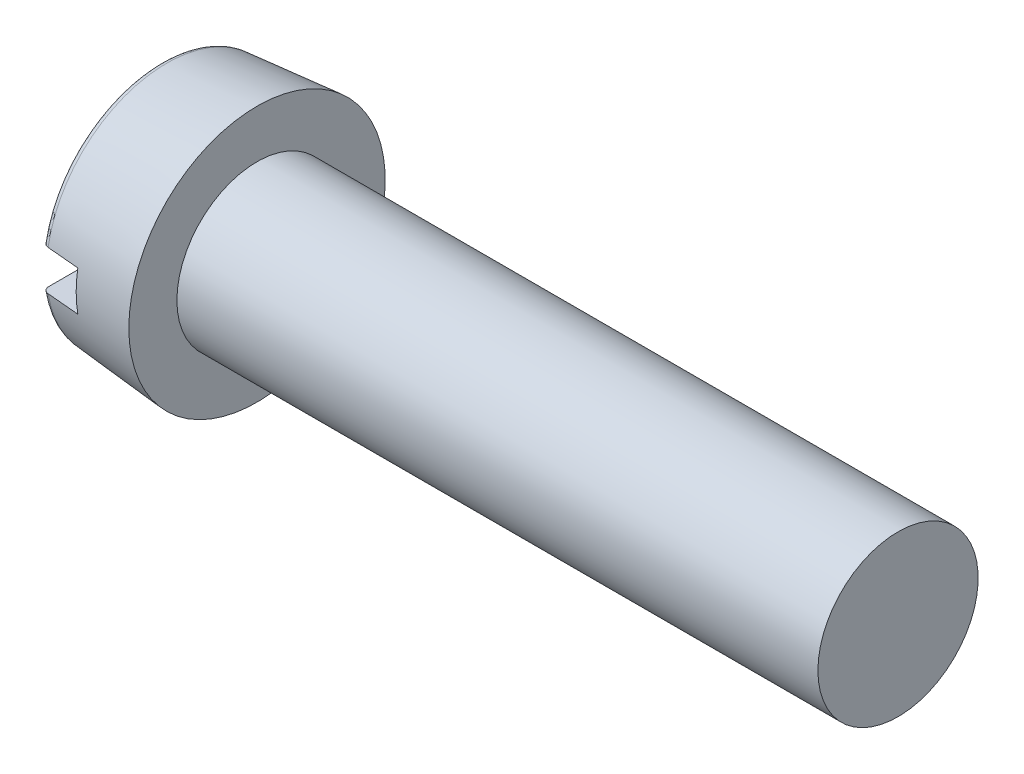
SolidWorks part; units mm, degrees
ref_plane "Front Plane" through (0, 0, 0) normal (0, 0, 1) x (1, 0, 0)
ref_plane "Top Plane" through (0, 0, 0) normal (0, 1, 0) x (1, 0, 0)
ref_plane "Right Plane" through (0, 0, 0) normal (1, 0, 0) x (0, 0, -1)
other "Configuration Table"
sketch "BodySke" plane through (0, 0, 0) normal (0, 0, 1) x (1, 0, 0)
  line L0 (0, 0) -> (111.3824, 0) construction
  line L1 (0, 0) -> (0, 7.4751)
  line L2 (0, 7.4751) -> (6, 8)
  line L3 (6, 8) -> (6, 5)
  line L4 (6, 5) -> (46, 5)
  line L5 (46, 5) -> (46, 0)
  line L6 (7.5, 8.824) -> (7.5, -5.8939) construction
  line L7 (0, 0) -> (46, 0)
  line L8 (8, 8.824) -> (8, -4.958) construction
  point P10 (46, 4.172)
revolve "BaseBody" add sketch "BodySke" angle 360 about L0
fillet "Fillet1" radius 0.4 1 edges at (0, 0, 7.4751)
sketch "SlotSke" plane through (0, 0, 0) normal (-1, 0, 0) x (0, 0, 1)
  line L1 (-8, 1.25) -> (8, 1.25)
  line L2 (-8, 1.25) -> (-8, -1.25)
  line L3 (-8, -1.25) -> (8, -1.25)
  line L4 (8, 1.25) -> (8, -1.25)
extrude "Slot" cut sketch "SlotSke" against normal blind 2.4
sketch "ThdSchSke" plane through (0, 0, 0) normal (0, 0, 1) x (1, 0, 0)
  line L0 (0, 0) -> (55.1256, 0) construction
  line L1 (0, 0) -> (111.3824, 0) construction
  line L2 (45.522, 5) -> (45.522, 5.9561)
  line L3 (45.522, 5.9561) -> (46.478, 5.9561)
  line L4 (46.478, 5.9561) -> (46.478, 5)
  line L5 (46.478, 5) -> (46, 4.172)
  line L6 (46, 4.172) -> (45.522, 5)
  line L7 (6, 5) -> (46, 5) construction
  line L13 (46, 5) -> (46, 0) construction
revolve "ThreadSchematic" [suppressed] cut sketch "ThdSchSke" angle 360 about L0
pattern_linear "ThdSchPat" [suppressed] count 25 along (1, 0, 0)
equation "\"Thread_minor@ThreadCosmetic\" = \"Thread_minor@BodySke\""
equation "\"D1@SlotSke\" = \"Head_dia@BodySke\""
equation "\"D2@SlotSke\" = \"D1@SlotSke\" / 2"
equation "\"D3@SlotSke\" = \"Slot_width@SlotSke\" / 2"
equation "\"Advance@ThdSchPat\" = \"Advance@BodySke\""
equation "\"D1@ThdSchPat\" =  int( \"Thread_length@BodySke\" / \"Advance@ThdSchPat\" ) "
